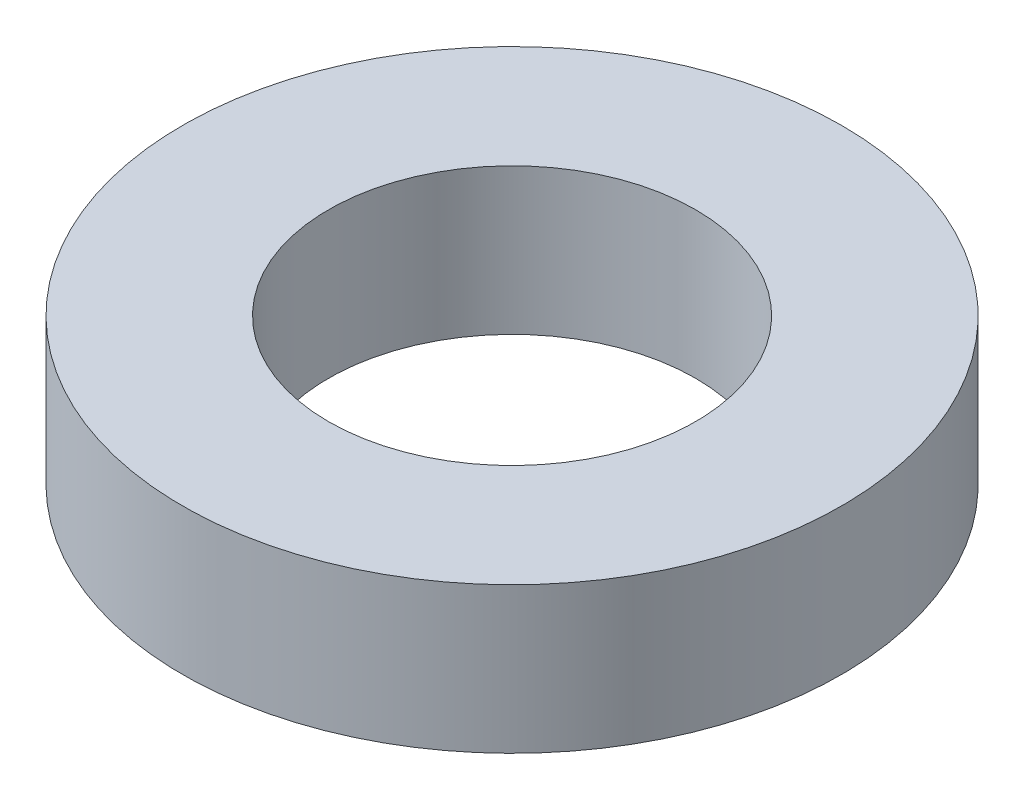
SolidWorks part; units mm, degrees
ref_plane "Front Plane" through (0, 0, 0) normal (0, 0, 1) x (1, 0, 0)
ref_plane "Top Plane" through (0, 0, 0) normal (0, 1, 0) x (1, 0, 0)
ref_plane "Right Plane" through (0, 0, 0) normal (1, 0, 0) x (0, 0, -1)
sketch "Sketch1" plane through (0, 0, 0) normal (0, 0, 1) x (1, 0, 0)
  line L0 (0, 0) -> (0, 6.6887) construction
  line L2 (-2.2352, 1.778) -> (-4.0132, 1.778)
  line L3 (-2.2352, 1.778) -> (-2.2352, 0)
  line L4 (-2.2352, 0) -> (-4.0132, 0)
  line L5 (-4.0132, 1.778) -> (-4.0132, 0)
  dimension "D1" = 4.4704
  dimension "D2" = 8.0264
  dimension "D3" = 1.778
revolve "Revolve1" add sketch "Sketch1" angle 360 about L0
